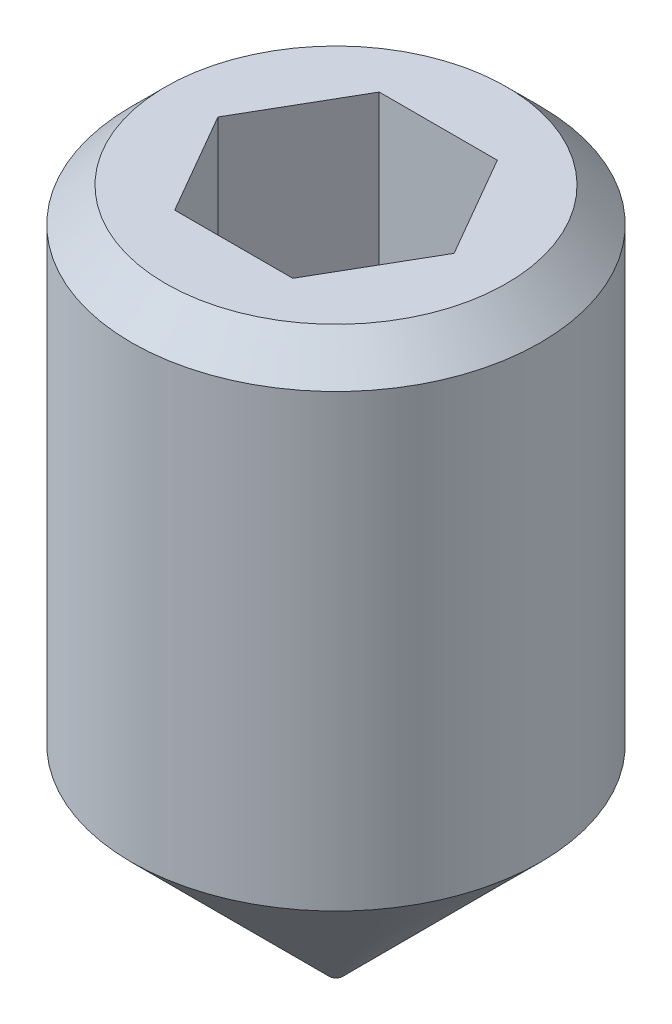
SolidWorks part; units mm, degrees
ref_plane "Plane1" through (0, 0, 0) normal (0, 0, 1) x (1, 0, 0)
ref_plane "Plane2" through (0, 0, 0) normal (0, 1, 0) x (1, 0, 0)
ref_plane "Plane3" through (0, 0, 0) normal (1, 0, 0) x (0, 0, -1)
sketch "Esquisse1" plane through (0, 0, 0) normal (0, 1, 0) x (1, 0, 0)
  circle A0 centre (0, 0) radius 1.5
  dimension "D1" = 3
extrude "Longueur filté" add sketch "Esquisse1" along normal blind 5
chamfer "Chanfrein1" distance 0.25 angle 45 1 edges at (0, 5, 1.5)
sketch "Esquisse6" plane through (0, 5, 0) normal (0, -1, 0) x (-1, 0, 0)
  line L1 (0.866, 0) -> (0.433, 0.75)
  line L2 (0.433, 0.75) -> (-0.433, 0.75)
  line L3 (-0.433, 0.75) -> (-0.866, 0)
  line L4 (-0.866, 0) -> (-0.433, -0.75)
  line L5 (-0.433, -0.75) -> (0.433, -0.75)
  line L6 (0.433, -0.75) -> (0.866, 0)
  circle A0 centre (0, 0) radius 0.75 construction
  dimension "S" = 1.5
extrude "Enlèv. mat.-Extru.4" cut sketch "Esquisse6" along normal blind 2
sketch "Esquisse9" plane through (0, 0, 0) normal (1, 0, 0) x (0, 0, -1)
  line L0 (-1.5, 4.75) -> (-1.5, 0) construction
  line L1 (-0.05, 0) -> (-1.5, 1.45)
  line L2 (-1.5, 1.45) -> (-1.5, 0)
  line L3 (-1.5, 0) -> (1.5, 0) construction
  line L4 (0, 0) -> (0, 2.3876) construction
  line L5 (-1.5, 0) -> (-0.05, 0)
  dimension "D1" = 45
  dimension "D2" = 0.1
revolve "Enlèvement de matière-Révolution2" cut sketch "Esquisse9" angle 360 about L4
equation "\"Ch@Chanfrein1\" = (\"D1@Esquisse1\"-\"D2@Représentation de filetage1\")/2"
